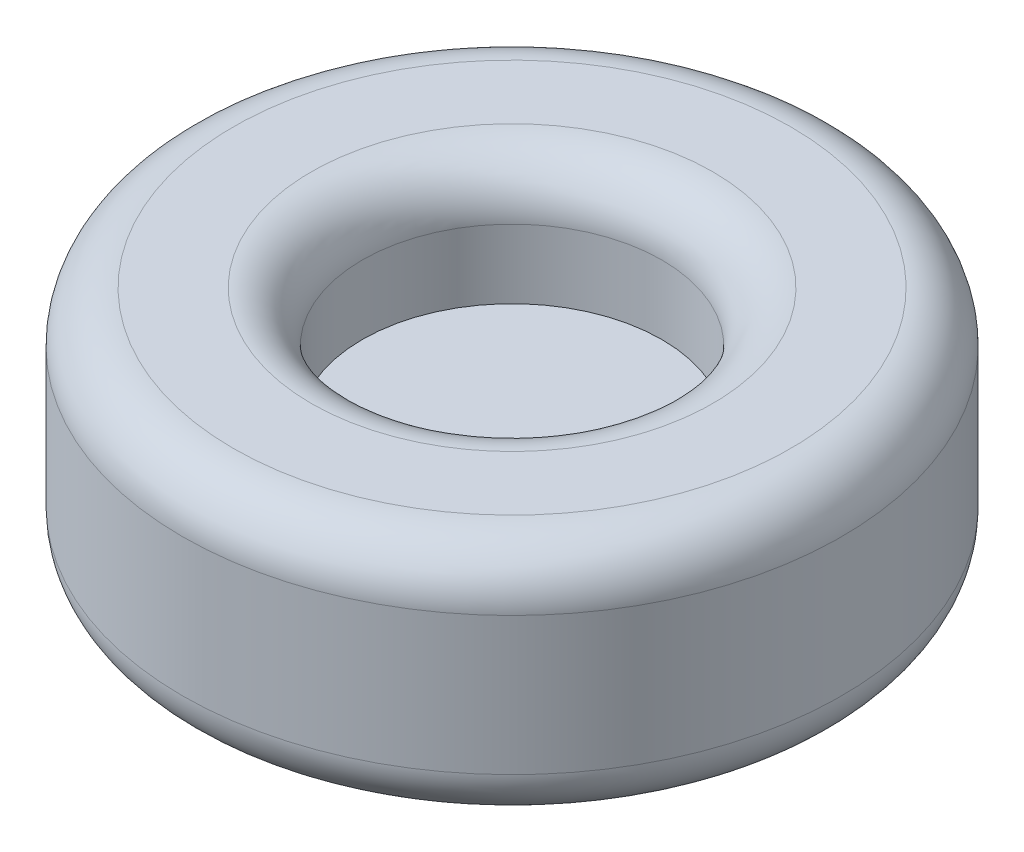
SolidWorks part; units mm, degrees
ref_plane "Front Plane" through (0, 0, 0) normal (0, 0, 1) x (1, 0, 0)
ref_plane "Top Plane" through (0, 0, 0) normal (0, 1, 0) x (1, 0, 0)
ref_plane "Right Plane" through (0, 0, 0) normal (1, 0, 0) x (0, 0, -1)
sketch "Sketch1" plane through (0, 0, 0) normal (0, 1, 0) x (1, 0, 0)
  circle A0 centre (0, 0) radius 279.4
  dimension "D1" = 558.8
extrude "Boss-Extrude1" add sketch "Sketch1" along normal blind 114.3 and the other way blind 88.9
fillet "Fillet1" radius 43.18 2 edges at (0, -88.9, 279.4) (0, 114.3, 279.4)
sketch "Sketch2" plane through (0, 114.3, 0) normal (0, 1, 0) x (1, 0, 0)
  circle A0 centre (0, 0) radius 127
  dimension "D1" = 254
extrude "Cut-Extrude1" cut sketch "Sketch2" against normal blind 101.6
fillet "Fillet2" radius 43.18 1 edges at (0, 114.3, 127)
